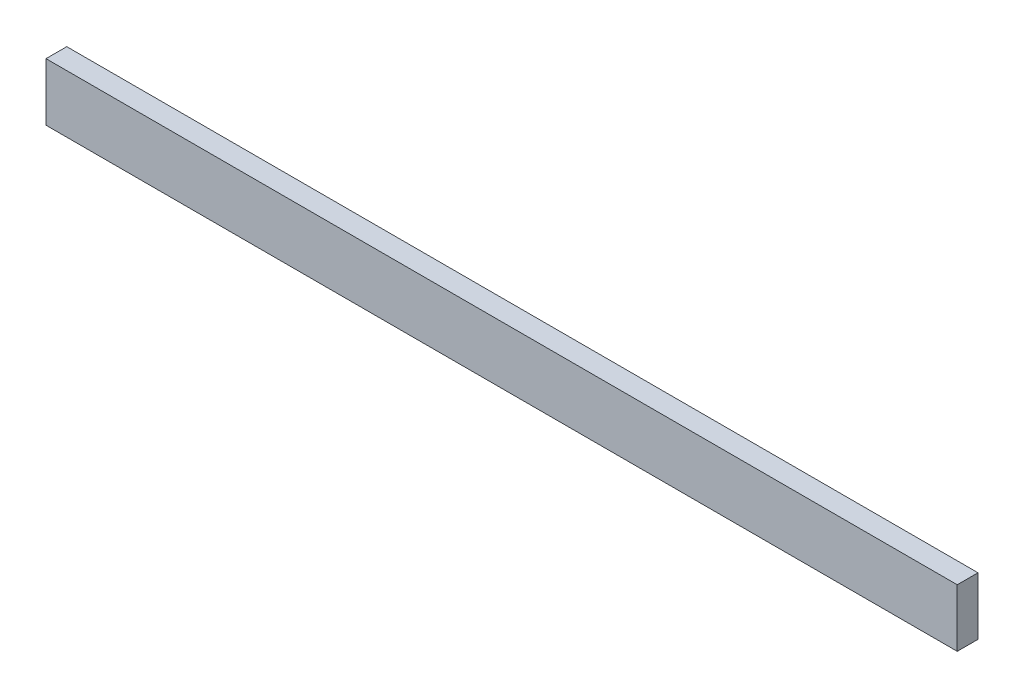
SolidWorks part; units mm, degrees
ref_plane "Plano frontal" through (0, 0, 0) normal (0, 0, 1) x (1, 0, 0)
ref_plane "Plano superior" through (0, 0, 0) normal (0, 1, 0) x (1, 0, 0)
ref_plane "Plano direito" through (0, 0, 0) normal (1, 0, 0) x (0, 0, -1)
sketch "Esboço1" plane through (0, 0, 0) normal (0, 0, 1) x (1, 0, 0)
  line L0 (-201, -1000) -> (49799, -1000) construction
  line L1 (-196, -756) -> (49804, -756) construction
  line L2 (-201, -950) -> (49799, -950) construction
  line L3 (9, -1801.5014) -> (9, 48198.4986) construction
  line L5 (799, -1878) -> (799, 48122) construction
  line L6 (799, -1000) -> (799, -756) construction
  line L8 (9, -950) -> (799, -950)
  line L9 (9, -950) -> (9, -1000)
  line L10 (9, -1000) -> (799, -1000)
  line L11 (799, -950) -> (799, -1000)
  point P15 (799, -878)
  dimension "D1" = 50
extrude "Ressalto-extrusão1" add sketch "Esboço1" against normal blind 18
